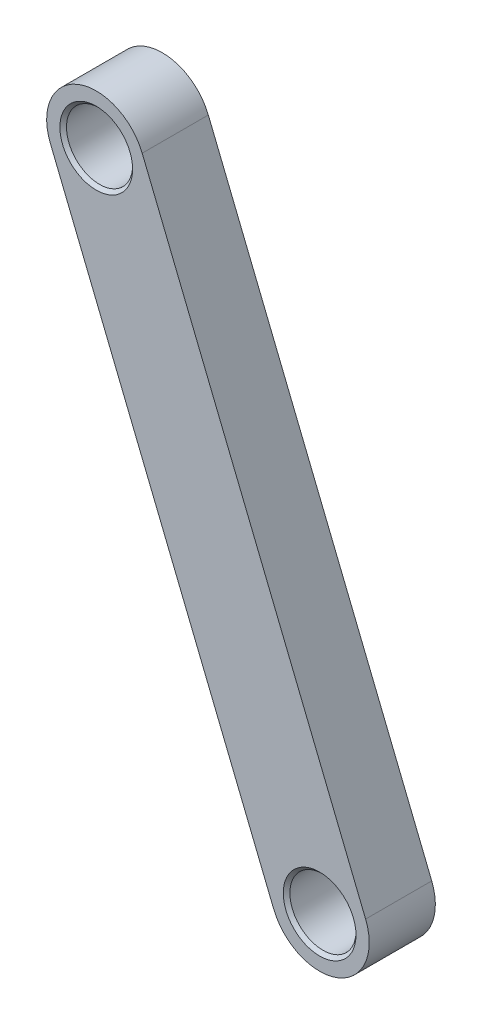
SolidWorks part; units mm, degrees
ref_plane "Plan de face" through (0, 0, 0) normal (0, 0, 1) x (1, 0, 0)
ref_plane "Plan de dessus" through (0, 0, 0) normal (0, 1, 0) x (1, 0, 0)
ref_plane "Plan de droite" through (0, 0, 0) normal (1, 0, 0) x (0, 0, -1)
sketch "Esquisse1" plane through (0, 0, 0) normal (0, 0, 1) x (1, 0, 0)
  line L0 (47.8172, 122.2537) -> (-19.755, 289.089)
  line L1 (75.6231, 133.5158) -> (8.0509, 300.351)
  circle A0 centre (-5.8521, 294.72) radius 10
  arc A1 (8.0509, 300.351) -> (-19.755, 289.089) centre (-5.8521, 294.72) ccw
  arc A2 (47.8172, 122.2537) -> (75.6231, 133.5158) centre (61.7202, 127.8848) ccw
  circle A3 centre (61.7202, 127.8848) radius 10
  dimension "D1" = 30
  dimension "D2" = 30
  dimension "D3" = 20
  dimension "D4" = 20
  dimension "D5" = 180
extrude "Boss.-Extru.1" add sketch "Esquisse1" along normal blind 20
chamfer "Chanfrein1" distance 1 angle 45 4 edges at (4.1479, 294.72, 0) (4.1479, 294.72, 20) (71.7202, 127.8848, 0) (71.7202, 127.8848, 20)
